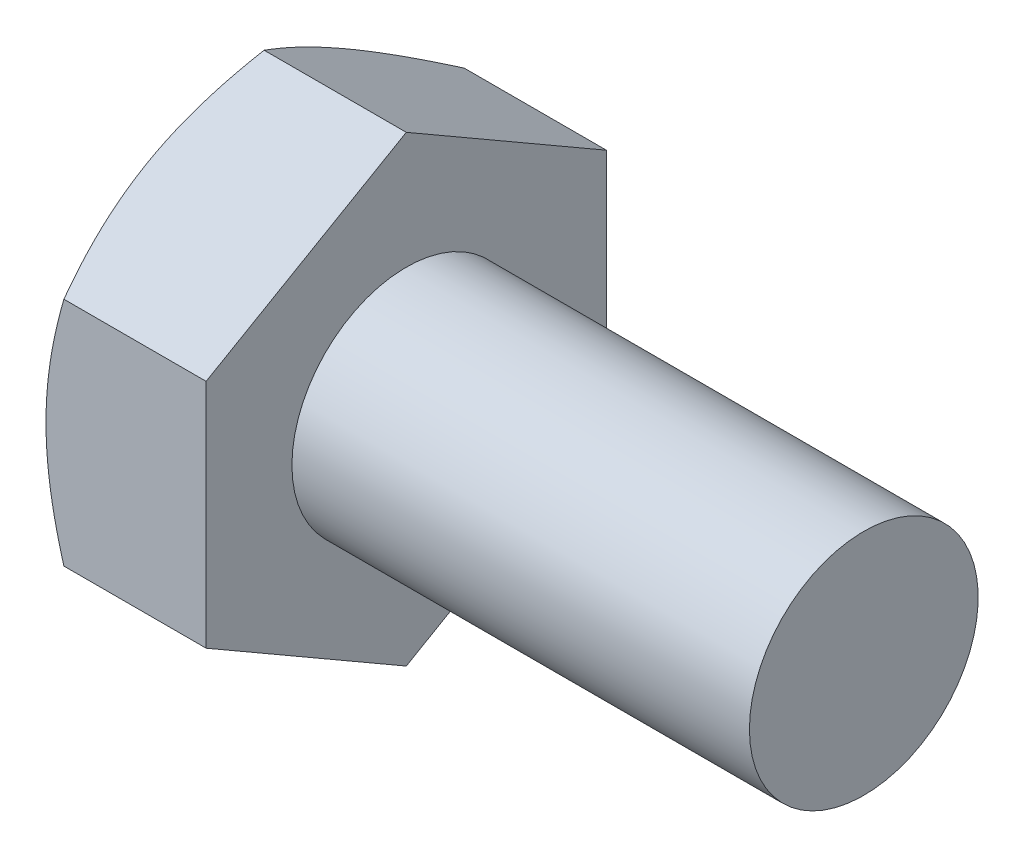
SolidWorks part; units mm, degrees
ref_plane "Front Plane" through (0, 0, 0) normal (0, 0, 1) x (1, 0, 0)
ref_plane "Top Plane" through (0, 0, 0) normal (0, 1, 0) x (1, 0, 0)
ref_plane "Right Plane" through (0, 0, 0) normal (1, 0, 0) x (0, 0, -1)
ref_plane "Dim.M" through (4, 0, 0) normal (1, 0, 0) x (0, 0, -1)
sketch "Sketch1" plane through (0, 0, 0) normal (0, 0, 1) x (1, 0, 0)
  line L0 (0, 0) -> (8, 0) construction
  line L2 (0, 2) -> (8, 2)
  line L3 (0, 2) -> (0, 0)
  line L4 (0, 0) -> (8, 0)
  line L5 (8, 2) -> (8, 0)
  dimension "L" = 8
revolve "Revolve1" add sketch "Sketch1" about L0
sketch "Sketch2" plane through (0, 0, 0) normal (-1, 0, 0) x (0, 0, 1)
  line L1 (0, 4.0415) -> (-3.5, 2.0207)
  line L2 (-3.5, 2.0207) -> (-3.5, -2.0207)
  line L3 (-3.5, -2.0207) -> (0, -4.0415)
  line L4 (0, -4.0415) -> (3.5, -2.0207)
  line L5 (3.5, -2.0207) -> (3.5, 2.0207)
  line L6 (3.5, 2.0207) -> (0, 4.0415)
  circle A0 centre (0, 0) radius 3.5 construction
extrude "Boss-Extrude1" add sketch "Sketch2" along normal blind 2.8
sketch "Sketch3" plane through (0, 0, 0) normal (0, 0, 1) x (1, 0, 0)
  line L0 (-2.8, 0) -> (0, 0) construction
  line L1 (-2.8, 4.0415) -> (-2.8, 3.5)
  line L2 (-2.8, 3.5) -> (-2.487, 4.0415)
  line L5 (-2.8, 4.0415) -> (0, 4.0415) construction
  line L12 (-2.487, 4.0415) -> (-2.8, 4.0415)
  dimension "MSM_1" = 0.313
  dimension "E" = 2.8
revolve "Cut-Revolve1" cut sketch "Sketch3" about L0
equation "\"Pitch_M\"= IIF ( \"M\" = 24 , 3 , IIF ( \"M\" = 22 , 2.5 , IIF ( \"M\" = 20 , 2.5 , IIF ( \"M\" = 18 , 2.5 , IIF ( \"M\" = 16 , 2 , IIF ( \"M\" = 14 , 2 , IIF ( \"M\" = 12 , 1.75 , IIF ( \"M\" = 10 , 1.5 , IIF ( \"M\" "
equation "\"Factor\"= 1.082532mm"
equation "\"ATD_1\"= round ( \"M\" - \"Factor\" * \"Pitch_M\" , 3 )"
